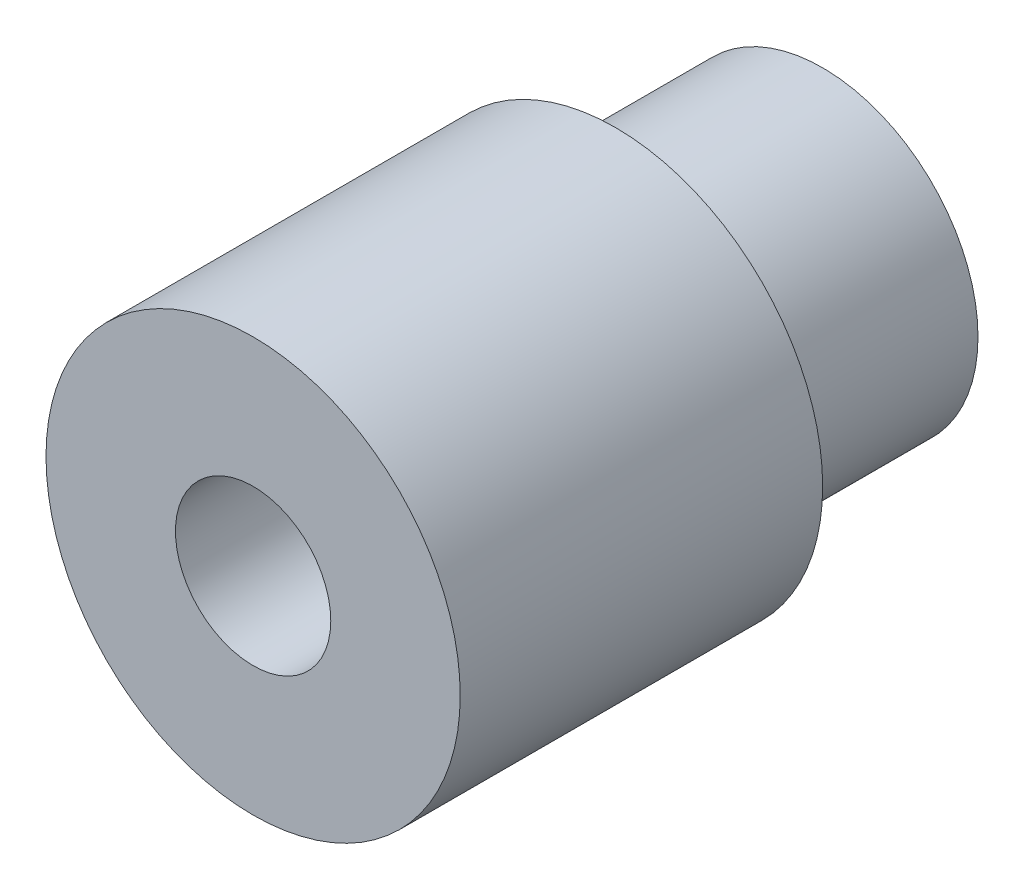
SolidWorks part; units mm, degrees
ref_plane "Front" through (0, 0, 0) normal (0, 0, 1) x (1, 0, 0)
ref_plane "Top" through (0, 0, 0) normal (0, 1, 0) x (1, 0, 0)
ref_plane "Right" through (0, 0, 0) normal (1, 0, 0) x (0, 0, -1)
sketch "Sketch1" plane through (0, 0, 0) normal (0, 0, 1) x (1, 0, 0)
  circle A1 centre (0, 0) radius 8
  dimension "D1" = 16
extrude "Extrude1" add sketch "Sketch1" along normal blind 14
sketch "Sketch2" plane through (0, 0, 0) normal (0, 0, -1) x (-1, 0, 0)
  circle A0 centre (0, 0) radius 6
  dimension "D1" = 12
extrude "Extrude2" add sketch "Sketch2" along normal blind 8
sketch "Sketch3" plane through (0, 0, 14) normal (0, 0, 1) x (1, 0, 0)
  circle A0 centre (0, 0) radius 3
  dimension "D1" = 6
extrude "Cut-Extrude1" cut sketch "Sketch3" against normal through all
